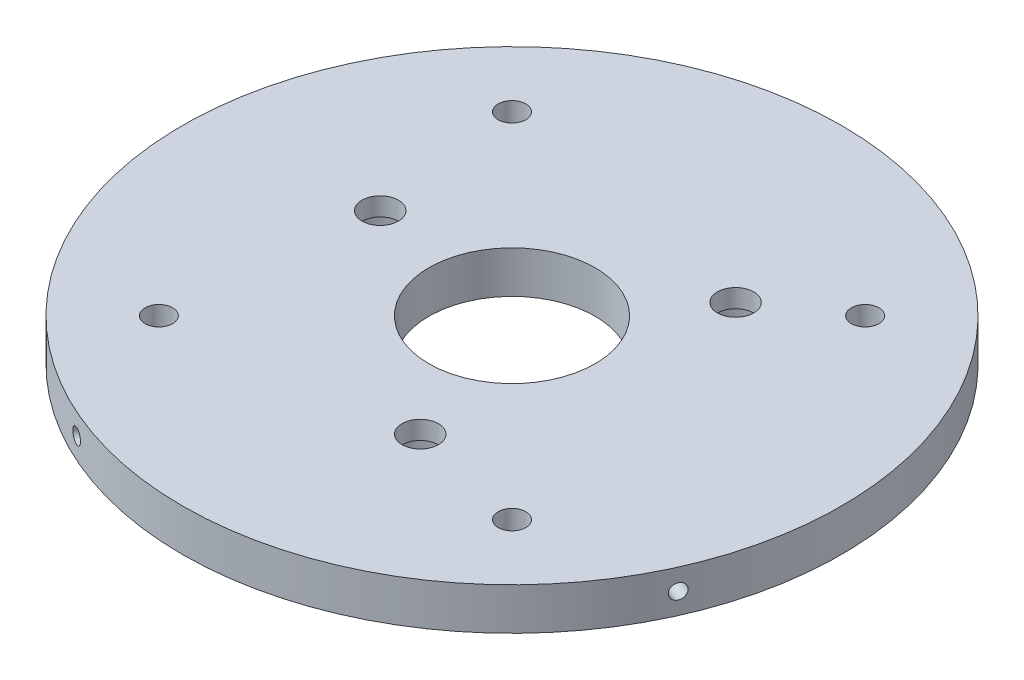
SolidWorks part; units mm, degrees
ref_plane "Front Plane" through (0, 0, 0) normal (0, 0, 1) x (1, 0, 0)
ref_plane "Top Plane" through (0, 0, 0) normal (0, 1, 0) x (1, 0, 0)
ref_plane "Right Plane" through (0, 0, 0) normal (1, 0, 0) x (0, 0, -1)
ref_axis "Axis1" through (0, 6.6675, 0) along (0, -1, 0)
sketch "Sketch1" plane through (0, 0, 0) normal (0, 1, 0) x (1, 0, 0)
  circle A0 centre (0, 0) radius 49.7713
  circle A1 centre (0, 0) radius 12.5603
  dimension "D1" = 99.5426
  dimension "D2" = 25.1206
extrude "Boss-Extrude1" add sketch "Sketch1" along normal blind 6.35
hole_wizard "#8-32 Tapped Hole1" positions "Sketch3" profile "Sketch2" tap size "#8-32" standard "ANSI Inch"
sketch "Sketch3" plane through (0, 6.35, 0) normal (0, 1, 0) x (1, 0, 0)
  circle A0 centre (-26.67, -26.67) radius 2.4574 construction
  circle A1 centre (-26.67, 26.67) radius 2.4574 construction
  circle A2 centre (26.67, 26.67) radius 2.4574 construction
  circle A3 centre (26.67, -26.67) radius 2.4574 construction
  point P0 (-26.67, 26.67)
  point P2 (26.67, 26.67)
  point P4 (-26.67, -26.67)
  point P6 (26.67, -26.67)
sketch "Sketch2" plane through (-26.67, 6.35, -26.67) normal (1, 0, 0) x (0, 0, 1)
  line L0 (0, 0) -> (0, 6.35)
  line L1 (0, 6.35) -> (2.0828, 6.35)
  line L2 (2.0828, 6.35) -> (2.0828, 0)
  line L5 (2.0828, 0) -> (0, 0)
  line L11 (0, -6.35) -> (0, 107.95) construction
  dimension "Thread Major Dia." = 4.1656
  dimension "Thru Tap Drill Depth" = 6.35
hole_wizard "CBORE for M5 Hex Head Bolt1" positions "Sketch5" profile "Sketch4" counterbore size "M5" standard "ANSI Metric"
sketch "Sketch5" plane through (0, 0, 0) normal (0, -1, 0) x (-1, 0, 0)
  circle A0 centre (-15.1383, 18.6234) radius 2.1 construction
  circle A1 centre (-8.5592, -22.4219) radius 2.1 construction
  circle A2 centre (23.6975, 3.7984) radius 2.1 construction
  point P0 (-15.1383, 18.6234)
  point P2 (-8.5592, -22.4219)
  point P4 (23.6975, 3.7984)
sketch "Sketch4" plane through (15.1383, 0, -18.6234) normal (1, 0, 0) x (0, 0, -1)
  line L0 (0, 0) -> (0, 6.35)
  line L1 (0, 6.35) -> (2.75, 6.35)
  line L3 (2.75, 6.35) -> (2.75, 3.58)
  line L4 (2.75, 3.58) -> (6.12, 3.58)
  line L5 (6.12, 3.58) -> (6.12, 0)
  line L7 (6.12, 0) -> (0, 0)
  line L11 (0, -6.35) -> (0, 107.95) construction
  dimension "Thru Hole Dia." = 5.5
  dimension "Thru Hole Depth" = 6.35
  dimension "C'Bore Dia." = 12.24
  dimension "C'Bore Depth" = 3.58
ref_plane "Plane1" through (-20.3311, 0, 45.4294) normal (-0.4085, 0, 0.9128) x (0, -1, 0)
hole_wizard "#4-40 Tapped Hole1" positions "Sketch7" profile "Sketch6" tap size "#4-40" standard "ANSI Inch"
sketch "Sketch7" plane through (-20.3311, 0, 45.4294) normal (-0.4085, 0, 0.9128) x (0, -1, 0)
  line L0 (0, 0) -> (-6.35, 0) construction
  line L1 (-6.35, 49.7713) -> (-6.35, -49.7713) construction
  point P3 (-3.175, 0)
sketch "Sketch6" plane through (-20.3311, 3.175, 45.4294) normal (0, 1, 0) x (0.9128, 0, 0.4085)
  line L0 (0, 0) -> (0, 10.8392)
  line L1 (0, 10.8392) -> (1.1303, 10.16)
  line L2 (1.1303, 10.16) -> (1.1303, 0)
  line L5 (1.1303, 0) -> (0, 0)
  line L10 (0, 10.8392) -> (-1.1303, 10.16) construction
  line L11 (0, -6.35) -> (0, 107.95) construction
  dimension "Tap Drill Dia." = 2.2606
  dimension "Tap Drill Depth" = 10.16
  dimension "Drill Angle" = 118
pattern_circular "CirPattern1" count 4 over 360 about axis through (0, 6.6675, 0) along (0, -1, 0) of "#4-40 Tapped Hole1"
